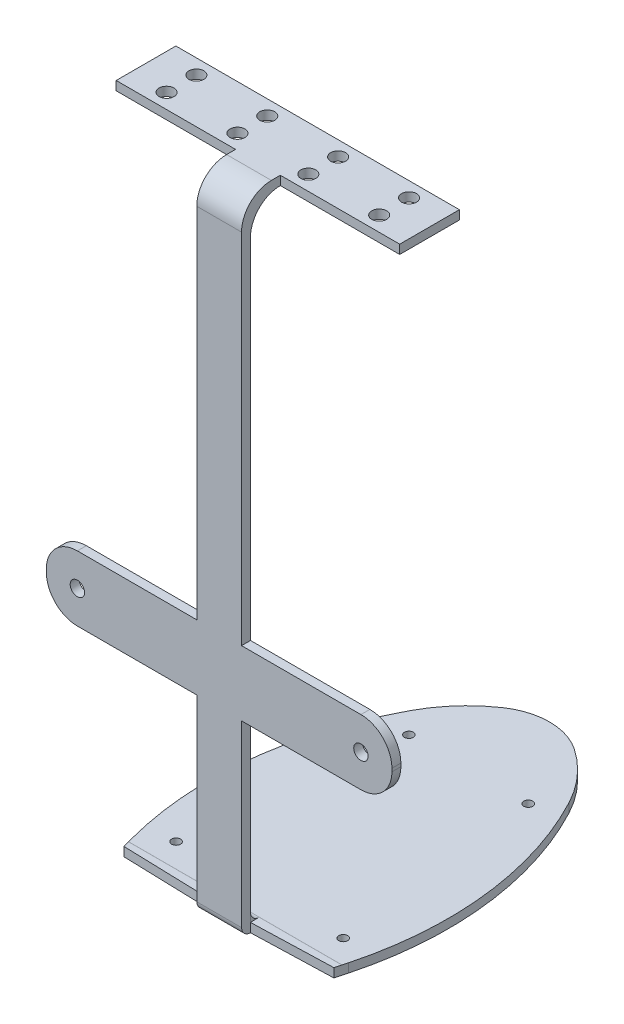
SolidWorks part; units mm, degrees
ref_plane "Front Plane" through (0, 0, 0) normal (0, 0, 1) x (1, 0, 0)
ref_plane "Top Plane" through (0, 0, 0) normal (0, 1, 0) x (1, 0, 0)
ref_plane "Right Plane" through (0, 0, 0) normal (1, 0, 0) x (0, 0, -1)
sketch "Sketch1" plane through (0, 0, 0) normal (0, 0, 1) x (1, 0, 0)
  line L0 (10.389, 0) -> (105.389, 0)
  line L1 (115.778, 10.389) -> (115.778, 11.432)
  line L2 (105.389, 21.821) -> (10.389, 21.821)
  line L3 (0, 11.432) -> (0, 10.389)
  arc A0 (115.778, 11.432) -> (105.389, 21.821) centre (105.389, 11.432) ccw
  arc A1 (105.389, 0) -> (115.778, 10.389) centre (105.389, 10.389) ccw
  arc A2 (10.389, 0) -> (0, 10.389) centre (10.389, 10.389) cw
  arc A3 (10.389, 21.821) -> (0, 11.432) centre (10.389, 11.432) ccw
  point P9 (115.778, 0)
  point P12 (0, 0)
  point P15 (0, 21.821)
  dimension "D3" = 10.389
  dimension "D1" = 115.778
  dimension "D2" = 21.821
extrude "Boss-Extrude1" add sketch "Sketch1" along normal blind 3
sketch "Sketch2" plane through (0, 0, 0) normal (0, 0, -1) x (-1, 0, 0)
  line L0 (-115.778, 10.9105) -> (0, 10.9105) construction
  line L1 (-107.798, 21.821) -> (-107.798, 0) construction
  line L2 (-105.389, 21.821) -> (-10.389, 21.821) construction
  line L3 (-10.389, 0) -> (-105.389, 0) construction
  line L4 (-7.98, 21.821) -> (-7.98, 0) construction
  line L5 (-115.778, 10.389) -> (-115.778, 11.432) construction
  line L6 (0, 11.432) -> (0, 10.389) construction
  circle A0 centre (-105.388, 10.9105) radius 2.41
  circle A1 centre (-10.39, 10.9105) radius 2.41
  dimension "D3" = 4.82
  dimension "D4" = 4.82
  dimension "D1" = 7.98
  dimension "D2" = 7.98
sketch "Sketch3" plane through (0, 21.821, 0) normal (0, 1, 0) x (1, 0, 0)
  line L0 (10.389, -1.5) -> (105.389, -1.5) construction
  line L1 (10.389, -3) -> (10.389, 0) construction
  line L2 (105.389, -3) -> (105.389, 0) construction
  line L3 (105.389, -3) -> (10.389, -3) construction
  line L4 (50.389, 0) -> (65.389, 0)
  line L5 (50.389, 0) -> (50.389, -3)
  line L6 (50.389, -3) -> (65.389, -3)
  line L7 (65.389, 0) -> (65.389, -3)
  line L8 (50.389, 0) -> (65.389, -3) construction
  line L9 (50.389, -3) -> (65.389, 0) construction
  point P6 (57.889, -1.5)
  dimension "D1" = 15
extrude "Boss-Extrude2" add sketch "Sketch3" along normal blind 130
sketch "Sketch4" plane through (0, 0, 0) normal (0, 0, -1) x (-1, 0, 0)
  line L0 (-65.389, 151.821) -> (-50.389, 151.821)
  line L1 (-50.389, 151.821) -> (-50.389, 148.821)
  line L2 (-50.389, 151.821) -> (-50.389, 21.821) construction
  line L3 (-50.389, 148.821) -> (-65.389, 148.821)
  line L4 (-65.389, 151.821) -> (-65.389, 21.821) construction
  line L5 (-65.389, 148.821) -> (-65.389, 151.821)
  dimension "D1" = 3
extrude "Boss-Extrude3" add sketch "Sketch4" along normal blind 30
fillet "Fillet4" radius 10 2 edges at (57.889, 148.821, 0) (57.889, 151.821, 3)
sketch "Sketch8" plane through (65.389, 0, 0) normal (1, 0, 0) x (0, 0, -1)
  line L0 (10, 148.821) -> (30, 148.821)
  line L1 (30, 148.821) -> (30, 151.821)
  line L2 (30, 151.821) -> (10, 151.821)
  line L3 (7, 151.821) -> (30, 151.821) construction
  line L4 (10, 151.821) -> (10, 148.821)
extrude "Boss-Extrude6" add sketch "Sketch8" along normal blind 40
sketch "Sketch9" plane through (50.389, 0, 0) normal (-1, 0, 0) x (0, 0, 1)
  line L0 (-10, 148.821) -> (-30, 148.821)
  line L1 (-30, 148.821) -> (-30, 151.821)
  line L2 (-30, 151.821) -> (-10, 151.821)
  line L3 (-10, 151.821) -> (-10, 148.821)
extrude "Boss-Extrude7" add sketch "Sketch9" along normal blind 40
extrude "Cut-Extrude2" cut sketch "Sketch2" against normal blind 10 contours A1 | A0
sketch "Sketch10" plane through (0, 151.821, 0) normal (0, 1, 0) x (1, 0, 0)
  line L0 (10.389, 20) -> (105.389, 20) construction
  line L1 (10.389, 10) -> (10.389, 30) construction
  line L2 (105.389, 30) -> (105.389, 10) construction
  line L3 (10.389, 30) -> (10.389, 20) construction
  line L4 (10.389, 25) -> (105.389, 25) construction
  line L5 (10.389, 20) -> (10.389, 10) construction
  line L6 (10.389, 15) -> (105.389, 15) construction
  line L7 (57.889, 30) -> (57.889, -2.9178) construction
  line L8 (10.389, 30) -> (105.389, 30) construction
  line L9 (57.889, 30) -> (105.389, 30) construction
  line L10 (81.639, 30) -> (81.639, 10) construction
  line L11 (105.389, 10) -> (65.389, 10) construction
  line L12 (81.639, 30) -> (105.389, 30) construction
  line L13 (81.639, 30) -> (105.389, 30) construction
  line L14 (105.389, 30) -> (93.514, 30) construction
  line L15 (93.514, 30) -> (93.514, 10) construction
  circle A0 centre (93.514, 25) radius 2.5
  circle A1 centre (93.514, 15) radius 2.5
  circle A2 centre (69.764, 15) radius 2.5
  circle A3 centre (69.764, 25) radius 2.5
  circle A4 centre (46.014, 15) radius 2.5
  circle A5 centre (22.264, 15) radius 2.5
  circle A6 centre (22.264, 25) radius 2.5
  circle A7 centre (46.014, 25) radius 2.5
  dimension "D1" = 5
extrude "Cut-Extrude3" cut sketch "Sketch10" against normal blind 10
ref_plane "Plane1" through (105.389, 0, 3) normal (1, 0, 0) x (0, 0, -1)
sketch "Sketch12" plane through (0, 0, 0) normal (0, -1, 0) x (1, 0, 0)
  line L0 (10.389, 3) -> (105.389, 3) construction
  line L1 (10.389, 1.5) -> (105.389, 1.5) construction
  line L2 (10.389, 3) -> (10.389, 0) construction
  line L3 (105.389, 3) -> (105.389, 0) construction
  line L4 (10.389, 0) -> (105.389, 0) construction
  line L5 (50.389, 3) -> (65.389, 3)
  line L6 (50.389, 3) -> (50.389, 0)
  line L7 (50.389, 0) -> (65.389, 0)
  line L8 (65.389, 3) -> (65.389, 0)
  line L9 (50.389, 3) -> (65.389, 0) construction
  line L10 (50.389, 0) -> (65.389, 3) construction
  point P10 (57.889, 1.5)
  dimension "D1" = 15
extrude "Boss-Extrude8" add sketch "Sketch12" along normal blind 60
sketch "Sketch14" plane through (0, -60, 0) normal (0, -1, 0) x (1, 0, 0)
  line L0 (50.389, 3) -> (134.4893, 3) construction
  line L1 (85.4752, -10.991) -> (77.4752, -80.991) construction
  line L2 (77.4752, -80.991) -> (37.4752, -80.991) construction
  line L3 (37.4752, -80.991) -> (29.4752, -10.991) construction
  line L4 (29.4752, -10.991) -> (85.4752, -10.991) construction
  line L5 (21.1076, -4.6754) -> (23.1428, 2.9657)
  line L6 (93.5087, -4.6754) -> (91.4734, 2.9657)
  line L7 (91.4734, 2.9657) -> (23.1428, 2.9657)
  line L8 (57.3081, -108.2896) -> (57.3081, 114.221) construction
  line L9 (91.4734, 2.9657) -> (23.1428, 2.9657) construction
  line L10 (65.389, 3) -> (50.389, 3) construction
  line L11 (65.389, 0) -> (65.389, 3) construction
  line L12 (65.389, 3) -> (50.389, 3) construction
  circle A0 centre (85.4752, -10.991) radius 1.5 construction
  circle A1 centre (29.4752, -10.991) radius 1.5 construction
  arc A2 (93.5087, -4.6754) -> (83.9651, -88.1816) centre (-17.6171, -34.2738) cw
  circle A4 centre (77.4752, -80.991) radius 1.5 construction
  circle A5 centre (37.4752, -80.991) radius 1.5 construction
  arc A7 (30.6512, -88.1816) -> (21.1076, -4.6754) centre (132.2334, -34.2738) cw
  arc A8 (45.2823, -104.5647) -> (69.3339, -104.5647) centre (57.3081, -87.0146) ccw
  arc A9 (83.9651, -88.1816) -> (69.3339, -104.5647) centre (43.3322, -66.6185) cw
  arc A10 (45.2823, -104.5647) -> (30.6512, -88.1816) centre (71.2841, -66.6185) cw
  arc A11 (92.5294, 3) -> (92.603, 3.2454) centre (88.6025, 4.3109) ccw
  circle A12 centre (85.4752, -10.991) radius 1.5
  circle A13 centre (29.4752, -10.991) radius 1.5
  circle A14 centre (77.4752, -80.991) radius 1.5
  circle A15 centre (37.4752, -80.991) radius 1.5
  point P17 (33.1259, -95.0633)
  point P28 (57.3081, -108.2896)
  point P29 (57.3081, 2.9657)
  dimension "D1" = 3
  dimension "D2" = 115
  dimension "D3" = 21.275
  dimension "D4" = 46
  dimension "D5" = 4.14
  dimension "D18" = 3
  dimension "D6" = 3.9449
  dimension "D7" = 5.8951
  dimension "D8" = 12.0862
  dimension "D9" = 18.5761
  dimension "D10" = 20.0862
  dimension "D11" = 23.2135
  dimension "D12" = 26.0844
  dimension "D13" = 27.1404
  dimension "D14" = 27.214
  dimension "D15" = 28.1197
  dimension "D16" = 27.9138
  dimension "D17" = 0.0343
  dimension "D19" = 13.991
  dimension "D21" = 32.2631
  dimension "D23" = 83.991
  dimension "D26" = 98.0633
extrude "Boss-Extrude10" add sketch "Sketch14" along normal blind 3 contours A10 A8 A9 A2 L6 L7 L5 A7 M18 M21 M20 | L7 M18 M20 M21
sketch "Sketch16" plane through (0, -60, 0) normal (0, 1, 0) x (1, 0, 0)
  line L0 (65.389, 0) -> (92.491, 0.8548)
  line L1 (93.5087, 4.6754) -> (91.4734, -2.9657) construction
  line L2 (92.491, 0.8548) -> (91.4734, -2.9657)
  line L3 (91.4734, -2.9657) -> (65.389, -2.9657)
  line L4 (65.389, -2.9657) -> (65.389, 0)
  line L5 (50.389, 0) -> (50.389, -2.9657)
  line L6 (50.389, 0) -> (22.1252, 0.8548)
  line L7 (21.1076, 4.6754) -> (23.1428, -2.9657) construction
  line L8 (22.1252, 0.8548) -> (23.1428, -2.9657)
  line L9 (23.1428, -2.9657) -> (50.389, -2.9657)
extrude "Cut-Extrude4" cut sketch "Sketch16" against normal blind 3
fillet "Fillet9" radius 3 1 edges at (57.889, -63, 2.9657)
fillet "Fillet10" radius 3 1 edges at (57.889, -60, 0)
sketch "Sketch17" plane through (0.065, 0, 2.0604) normal (0.0315, 0, 0.9995) x (0.9995, 0, -0.0315)
  line L0 (65.3565, -57) -> (65.3565, -59.9999)
  line L1 (65.3565, -62.9998) -> (65.3565, -57) construction
  line L2 (65.3565, -59.9999) -> (92.472, -59.9999)
  line L3 (92.472, -63) -> (92.472, -59.0972) construction
  line L4 (92.472, -59.9999) -> (92.472, -57)
  line L5 (92.472, -57) -> (65.3565, -57)
  line L6 (49.9955, -46.8779) -> (49.9955, -49.9999)
  line L7 (49.9955, -49.9999) -> (18.618, -49.9999)
  line L8 (18.618, -49.9999) -> (18.618, -46.8779)
  line L9 (18.618, -46.8779) -> (49.9955, -46.8779)
extrude "Cut-Extrude6" cut sketch "Sketch17" against normal blind 6
sketch "Sketch19" plane through (92.4261, 0, -2.9153) normal (-0.9995, 0, 0.0315) x (0.0315, 0, 0.9995)
  line L0 (2.0614, -59.9999) -> (-0.0606, -59.9999)
  line L1 (-0.0606, -59.9999) -> (-0.0606, -48.583)
  line L2 (-0.0606, -48.583) -> (2.0614, -48.583)
  line L3 (2.0614, -48.583) -> (2.0614, -59.9999)
extrude "Cut-Extrude10" cut sketch "Sketch19" against normal blind 0.5
sketch "Sketch23" plane through (0.0461, 0, -1.5226) normal (-0.0302, 0, 0.9995) x (0.9995, 0, 0.0302)
  line L0 (50.366, -57) -> (20.366, -57)
  line L1 (50.366, -62.9998) -> (50.366, -57) construction
  line L5 (50.366, -59.9999) -> (50.366, -57)
  line L6 (20.366, -57) -> (20.366, -59.9999)
  line L7 (20.366, -59.9999) -> (50.366, -59.9999)
  ellipse E0 centre (-48.8693, -57) end of major axis (-148.1045, -57) minor radius 3 (22.0893, -59.0972) -> (50.366, -57) ccw construction
  dimension "D1" = 30
extrude "Cut-Extrude13" cut sketch "Sketch23" against normal blind 50
